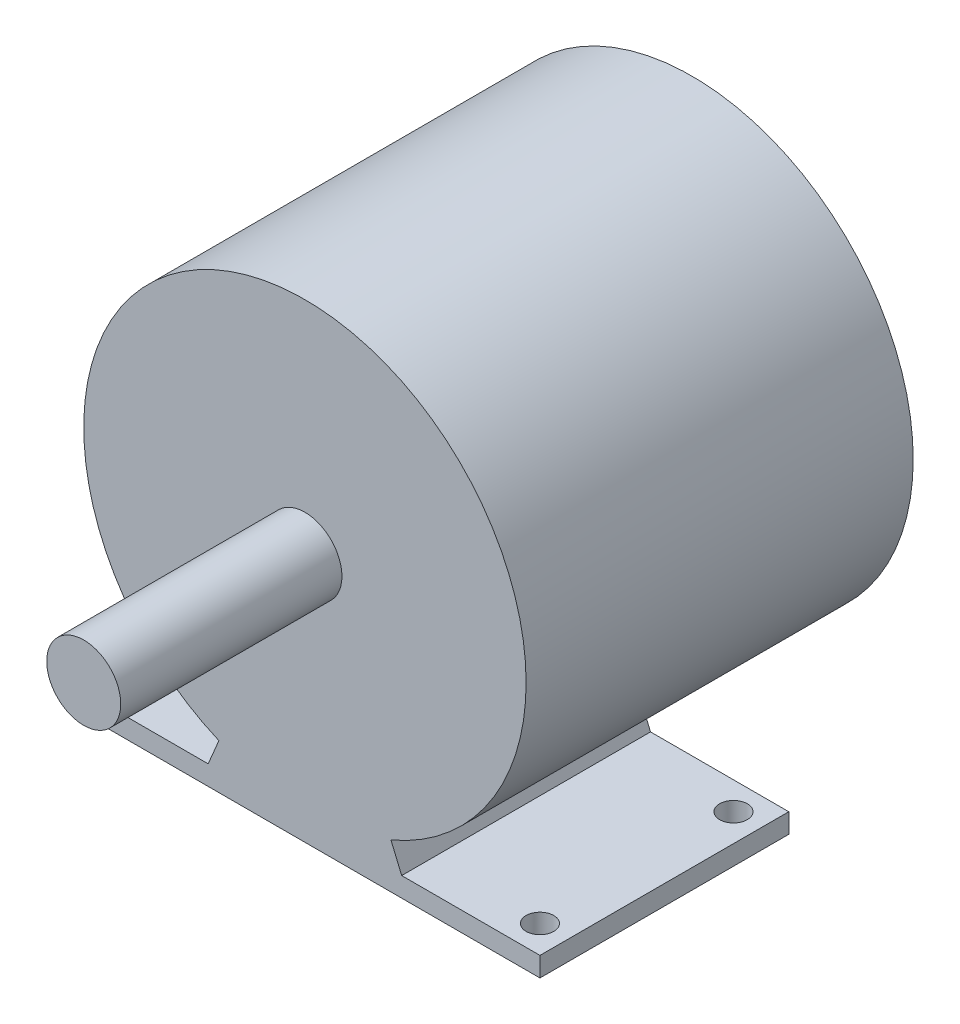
SolidWorks part; units mm, degrees
ref_plane "Front Plane" through (0, 0, 0) normal (0, 0, 1) x (1, 0, 0)
ref_plane "Top Plane" through (0, 0, 0) normal (0, 1, 0) x (1, 0, 0)
ref_plane "Right Plane" through (0, 0, 0) normal (1, 0, 0) x (0, 0, -1)
sketch "Sketch1" plane through (0, 0, 0) normal (0, 0, 1) x (1, 0, 0)
  circle A0 centre (0, 0) radius 50.8
  dimension "D1" = 101.6
extrude "Boss-Extrude1" add sketch "Sketch1" along normal blind 44.45 and the other way blind 44.45
sketch "Sketch2" plane through (0, 0, 44.45) normal (0, 0, 1) x (1, 0, 0)
  circle A0 centre (0, 0) radius 8.5
  dimension "D1" = 17
extrude "Boss-Extrude2" add sketch "Sketch2" along normal blind 50.8
sketch "Sketch6" plane through (0, 0, 44.45) normal (0, 0, 1) x (1, 0, 0)
  line L0 (-19.7556, -46.8013) -> (-22.225, -52.6514)
  line L1 (-22.225, -52.6514) -> (-53.975, -52.6514)
  line L2 (-53.975, -52.6514) -> (-53.975, -57.15)
  line L3 (-53.975, -57.15) -> (53.975, -57.15)
  line L4 (53.975, -57.15) -> (53.975, -52.6514)
  line L5 (53.975, -52.6514) -> (22.225, -52.6514)
  line L6 (22.225, -52.6514) -> (19.7556, -46.8013)
  arc A0 (-19.7556, -46.8013) -> (19.7556, -46.8013) centre (0, 0) ccw
  circle A1 centre (0, 0) radius 50.8 construction
  point P12 (0, -50.8)
  point P13 (0, -57.15)
  dimension "D1" = 107.95
  dimension "D2" = 6.35
  dimension "D4" = 31.75
  dimension "D5" = 31.75
  dimension "D6" = 6.35
  dimension "D7" = 6.35
extrude "Boss-Extrude3" add sketch "Sketch6" against normal blind 57.15
hole_wizard "1/4 (0.25) Diameter Hole2" positions "Sketch7" profile "Sketch8" hole size "1/4" standard "ANSI Inch"
sketch "Sketch7" plane through (0, -57.15, 0) normal (0, -1, 0) x (-1, 0, 0)
  line L0 (53.975, 12.7) -> (-53.975, 12.7) construction
  line L1 (53.975, -44.45) -> (-53.975, -44.45) construction
  point P0 (47.625, -38.1)
  point P2 (47.625, 6.35)
  point P4 (-47.625, 6.35)
  point P6 (-47.625, -38.1)
  dimension "D1" = 95.25
  dimension "D2" = 47.625
  dimension "D3" = 6.35
  dimension "D4" = 6.35
  dimension "D5" = 44.45
sketch "Sketch8" plane through (-47.625, -57.15, 38.1) normal (1, 0, 0) x (0, 0, -1)
  line L0 (0, 0) -> (0, 4.4986)
  line L1 (0, 4.4986) -> (3.175, 4.4986)
  line L2 (3.175, 4.4986) -> (3.175, 0)
  line L5 (3.175, 0) -> (0, 0)
  line L11 (0, -6.35) -> (0, 107.95) construction
  dimension "Thru Hole Dia." = 6.35
  dimension "Thru Hole Depth" = 4.4986
